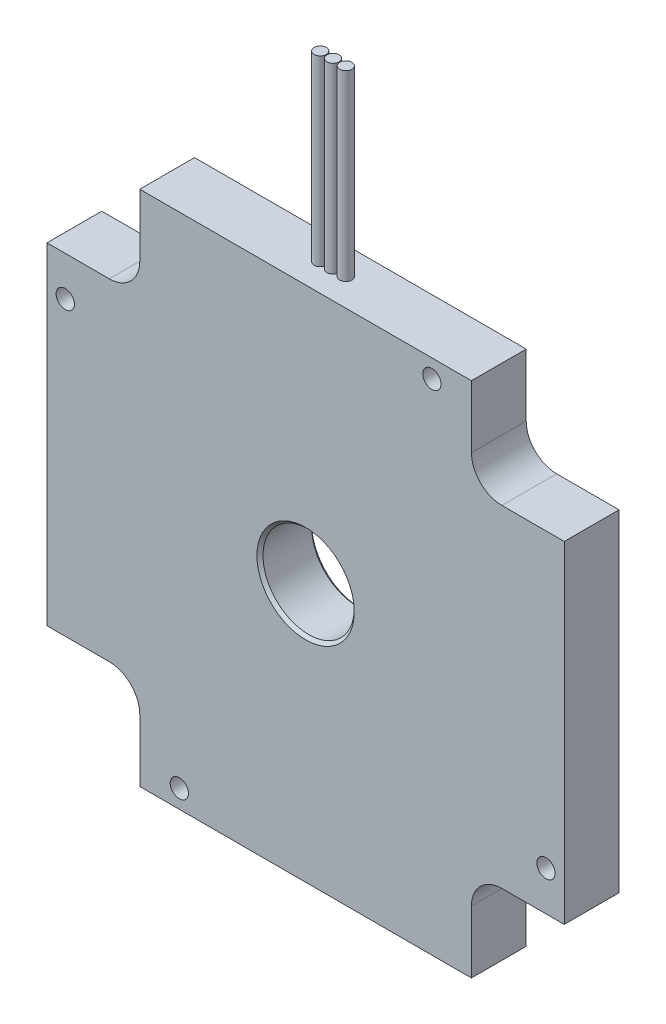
SolidWorks part; units mm, degrees
ref_plane "前视基准面" through (0, 0, 0) normal (0, 0, 1) x (1, 0, 0)
ref_plane "上视基准面" through (0, 0, 0) normal (0, 1, 0) x (1, 0, 0)
ref_plane "右视基准面" through (0, 0, 0) normal (1, 0, 0) x (0, 0, -1)
sketch "草图1" plane through (0, 0, 0) normal (0, 0, 1) x (1, 0, 0)
  line L0 (-27.25, 27.25) -> (-27.25, 42.5)
  line L1 (-42.5, 27.25) -> (-27.25, 27.25)
  line L2 (-42.5, 27.25) -> (-42.5, -27.25)
  line L3 (-42.5, -27.25) -> (-27.25, -27.25)
  line L4 (42.5, 27.25) -> (42.5, -27.25)
  line L5 (-42.5, 27.25) -> (42.5, -27.25) construction
  line L6 (-42.5, -27.25) -> (42.5, 27.25) construction
  line L7 (27.25, -42.5) -> (-27.25, -42.5)
  line L8 (27.25, -42.5) -> (27.25, -27.25)
  line L9 (27.25, 42.5) -> (-27.25, 42.5)
  line L10 (-27.25, -42.5) -> (-27.25, -27.25)
  line L11 (27.25, -42.5) -> (-27.25, 42.5) construction
  line L12 (27.25, 42.5) -> (-27.25, -42.5) construction
  line L13 (27.25, -27.25) -> (42.5, -27.25)
  line L14 (27.25, 27.25) -> (27.25, 42.5)
  line L15 (27.25, 27.25) -> (42.5, 27.25)
  point P0 (0, 0)
  point P6 (0, 0)
  dimension "D1" = 85
  dimension "D2" = 54.5
  dimension "D3" = 54.5
  dimension "D4" = 85
extrude "凸台-拉伸1" add sketch "草图1" along normal blind 9
sketch "草图2" plane through (0, 0, 9) normal (0, 0, 1) x (1, 0, 0)
  circle A0 centre (0, 0) radius 7.5
  dimension "D1" = 15
extrude "切除-拉伸1" cut sketch "草图2" against normal through all
chamfer "倒角2" distance 0.5 angle 45 2 edges at (7.5, 0, 0) (7.5, 0, 9)
sketch "草图3" plane through (0, 0, 9) normal (0, 0, 1) x (1, 0, 0)
  line L0 (-39.4977, 20.75) -> (-39.4977, 0) construction
  line L1 (-39.4977, 0) -> (0, 0) construction
  line L3 (-20.75, -39.5) -> (0, -39.5) construction
  line L4 (0, -39.5) -> (0, 0) construction
  line L5 (39.5, -20.75) -> (39.5, 0) construction
  line L7 (39.5, 0) -> (0, 0) construction
  line L8 (20.75, 39.5) -> (0, 39.5) construction
  line L10 (0, 39.5) -> (0, 0) construction
  circle A1 centre (-39.4977, 20.75) radius 1.5
  circle A2 centre (-20.75, -39.5) radius 1.5
  circle A3 centre (39.5, -20.75) radius 1.5
  circle A4 centre (20.75, 39.5) radius 1.5
  dimension "D3" = 3
  dimension "D6" = 3
  dimension "D9" = 3
  dimension "D12" = 3
  dimension "D2" = 20.75
  dimension "D4" = 20.75
  dimension "D5" = 20.75
  dimension "D7" = 20.75
  dimension "D8" = 39.5
  dimension "D10" = 39.5
  dimension "D11" = 39.4977
  dimension "D13" = 39.5
extrude "切除-拉伸2" cut sketch "草图3" against normal through all
fillet "圆角2" radius 5 4 edges at (27.25, 27.25, 4.5) (-27.25, 27.25, 4.5) (-27.25, -27.25, 4.5) (27.25, -27.25, 4.5)
sketch "草图4" plane through (0, 42.5, 0) normal (0, 1, 0) x (1, 0, 0)
  circle A0 centre (0, -4.5) radius 1
  circle A1 centre (-2.1, -4.5) radius 1
  circle A2 centre (2.1, -4.5) radius 1
  dimension "D1" = 2
  dimension "D2" = 2
extrude "凸台-拉伸2" add sketch "草图4" along normal blind 30
